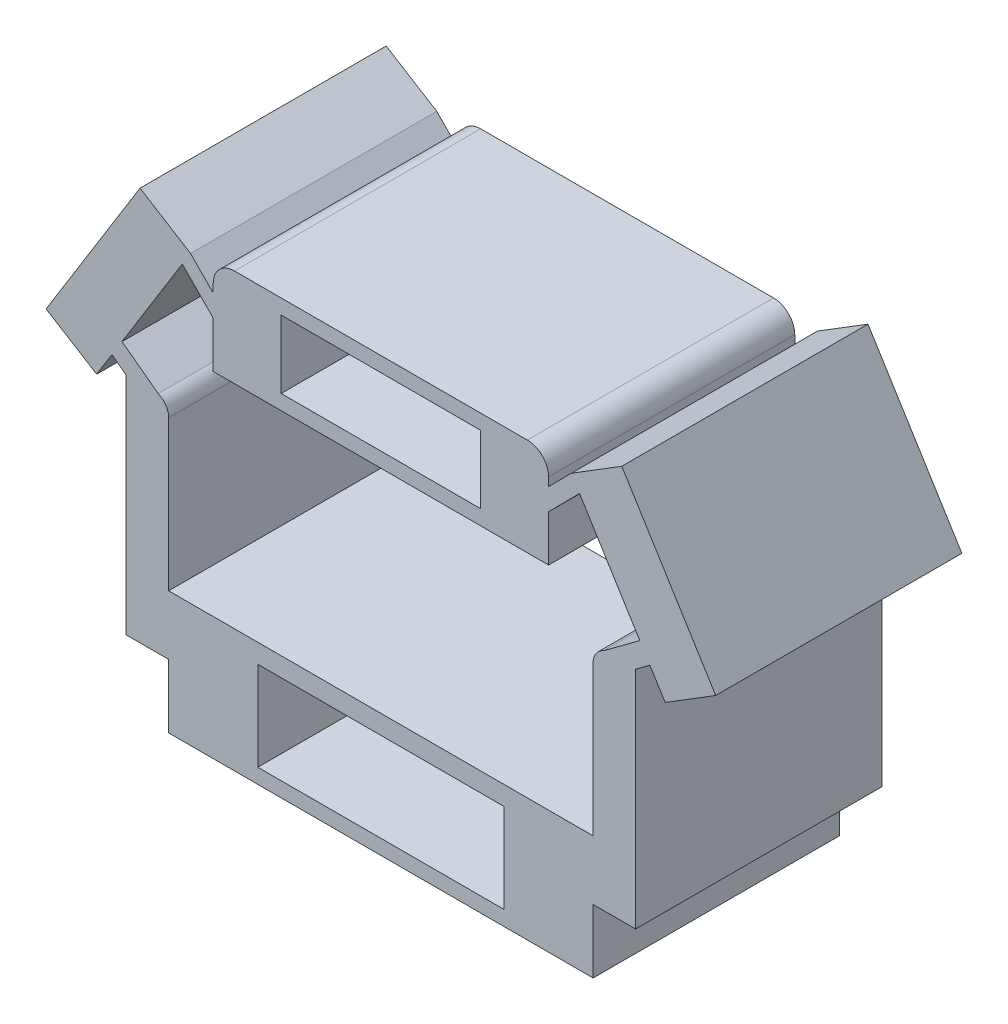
SolidWorks part; units mm, degrees
ref_plane "前视基准面" through (0, 0, 0) normal (0, 0, 1) x (1, 0, 0)
ref_plane "上视基准面" through (0, 0, 0) normal (0, 1, 0) x (1, 0, 0)
ref_plane "右视基准面" through (0, 0, 0) normal (1, 0, 0) x (0, 0, -1)
other "Configuration Table"
sketch "草图1" plane through (0, 0, 0) normal (0, 0, 1) x (1, 0, 0)
  line L0 (3.95, 8) -> (4.4846, 8.5402)
  line L1 (-5, -1.4) -> (5, -1.4)
  line L2 (-5, -1.4) -> (-5, 1.4)
  line L4 (5, -1.4) -> (5, 0)
  line L5 (-5, -1.4) -> (5, 1.4) construction
  line L6 (-5, 1.4) -> (5, -1.4) construction
  line L7 (-3.95, 8) -> (3.95, 8)
  line L8 (-3.95, 8) -> (-3.95, 6.4)
  line L9 (-3.95, 6.4) -> (3.95, 6.4)
  line L10 (3.95, 7.4882) -> (3.95, 6.4)
  line L11 (-3.95, 8) -> (3.95, 6.4) construction
  line L12 (-3.95, 6.4) -> (3.95, 8) construction
  line L14 (5, 0) -> (6, 0)
  line L17 (5.6746, 9.2776) -> (4.4846, 8.5402)
  line L19 (5.6746, 9.2776) -> (7.8869, 5.7075)
  line L33 (3.95, 8) -> (3.95, 7.4882) construction
  line L34 (4.4846, 8.5402) -> (4.6796, 8.2255) construction
  line L37 (6, 5.3) -> (6, 0)
  line L38 (-5, 1.4) -> (5, 1.4)
  line L39 (5, 1.4) -> (5, 0) construction
  line L40 (0, 9.062) -> (0, -4.0269) construction
  line L41 (3.95, 7.4882) -> (4.6796, 8.2255)
  line L48 (4.6796, 8.2255) -> (6.0993, 5.9343)
  line L51 (5.2453, 5.3) -> (6.0993, 5.9343)
  line L53 (6.3372, 5.5504) -> (6.6968, 4.97)
  line L55 (6.0993, 5.9343) -> (6.3372, 5.5504) construction
  line L56 (5.2453, 5.3) -> (6, 5.3) construction
  line L57 (5, 1.4) -> (5, 5.3)
  line L58 (5, 5.3) -> (5.2453, 5.3)
  line L59 (6, 5.3) -> (6.3372, 5.5504)
  line L60 (6.6968, 4.97) -> (7.8869, 5.7075)
  point P0 (0, 0)
  point P6 (0, 7.2)
  dimension "D1" = 10
  dimension "D2" = 2.8
  dimension "D3" = 7.9
  dimension "D4" = 1.6
  dimension "D5" = 1
  dimension "D6" = 36.6
  dimension "D7" = 0.76
  dimension "D8" = 0.36
  dimension "D9" = 5.3
  dimension "D10" = 1.4
  dimension "D11" = 0.45
  dimension "D12" = 3.9
  dimension "D13" = 0.42
  dimension "D14" = 5
  dimension "D15" = 4.2
  dimension "D16" = 135.3
extrude "凸台-拉伸1" add sketch "草图1" along normal blind 5.8
mirror "镜向1" about plane through (0, 0, 0) normal (1, 0, 0) of "凸台-拉伸1"
sketch "草图10" plane through (0, 0, 5.8) normal (0, 0, 1) x (1, 0, 0)
  line L0 (-3.95, 6.4) -> (3.95, 6.4) construction
  line L1 (-2.9, -1.05) -> (2.9, -1.05)
  line L2 (-2.9, -1.05) -> (-2.9, 1.05)
  line L3 (-2.9, 1.05) -> (2.9, 1.05)
  line L4 (2.9, -1.05) -> (2.9, 1.05)
  line L5 (-2.9, -1.05) -> (2.9, 1.05) construction
  line L6 (-2.9, 1.05) -> (2.9, -1.05) construction
  line L7 (-2.35, 8.35) -> (2.35, 8.35)
  line L8 (-2.35, 8.35) -> (-2.35, 6.75)
  line L9 (-2.35, 6.75) -> (2.35, 6.75)
  line L10 (2.35, 8.35) -> (2.35, 6.75)
  point P0 (0, 0)
  point P10 (0, 8.35)
  dimension "D1" = 5.8
  dimension "D2" = 2.1
  dimension "D3" = 4.7
  dimension "D4" = 1.6
  dimension "D5" = 0.35
extrude "切除-拉伸3" cut sketch "草图10" against normal through all
sketch "草图11" plane through (0, 0, 5.8) normal (0, 0, 1) x (1, 0, 0)
  line L0 (-2.35, 8) -> (-3.95, 8)
  line L1 (-3.95, 8) -> (-3.95, 8.7)
  line L2 (-3.95, 8.7) -> (3.95, 8.7)
  line L3 (3.95, 8.7) -> (3.95, 8)
  line L4 (3.95, 6.4) -> (3.95, 7.4882) construction
  line L5 (3.95, 8) -> (2.35, 8)
  line L6 (2.35, 8) -> (2.35, 8.35)
  line L7 (2.35, 8.35) -> (-2.35, 8.35)
  line L8 (-2.35, 8.35) -> (-2.35, 8)
  line L9 (-2.35, 6.75) -> (2.35, 6.75) construction
  dimension "D1" = 0.35
  dimension "D2" = 1.6
extrude "凸台-拉伸2" add sketch "草图11" against normal up to surface (5.8 mm away)
fillet "圆角1" radius 0.5 2 edges at (-3.95, 8.7, 2.9) (3.95, 8.7, 2.9)
sketch "草图12" plane through (0, 0, 5.8) normal (0, 0, 1) x (1, 0, 0)
  line L0 (-2.9, 1.05) -> (-2.9, -1.05) construction
  line L1 (-2.9, 0.95) -> (2.9, 0.95)
  line L2 (-2.9, 0.95) -> (-2.9, 1.05)
  line L3 (-2.9, 1.05) -> (2.9, 1.05)
  line L4 (2.9, 0.95) -> (2.9, 1.05)
  line L5 (5, -1.4) -> (5, 0) construction
  line L6 (-5, -1.4) -> (5, -1.4)
  line L7 (-5, -1.4) -> (-5, -1.5)
  line L8 (-5, -1.5) -> (5, -1.5)
  line L9 (5, -1.4) -> (5, -1.5)
  dimension "D1" = 0.1
  dimension "D2" = 0.1
extrude "凸台-拉伸3" add sketch "草图12" against normal up to surface (5.8 mm away)
sketch "草图14" plane through (0, 0, 5.8) normal (0, 0, 1) x (1, 0, 0)
  line L0 (2.9, -1.05) -> (2.9, 0.95) construction
  line L1 (-2.9, -1.05) -> (2.9, -1.05)
  line L2 (-2.9, -1.05) -> (-2.9, -1.15)
  line L3 (-2.9, -1.15) -> (2.9, -1.15)
  line L4 (2.9, -1.05) -> (2.9, -1.15)
  dimension "D1" = 0.1
extrude "切除-拉伸4" cut sketch "草图14" against normal through all
sketch "草图15" plane through (0, 0, 5.8) normal (0, 0, 1) x (1, 0, 0)
  line L0 (0, 8) -> (0, 1.4)
  line L2 (5, 1.4) -> (-5, 1.4) construction
  line L3 (0, 1.4) -> (5, 1.4)
  line L4 (5, 1.4) -> (5, 5.3)
  line L5 (5, 5.3) -> (6, 5.3)
  line L6 (6, 5.3) -> (6.3372, 5.5504)
  line L7 (6.3372, 5.5504) -> (4.4846, 8.5402)
  line L8 (4.4846, 8.5402) -> (3.95, 8)
  line L9 (3.95, 8) -> (0, 8)
sketch "草图16" plane through (0, 0, 5.8) normal (0, 0, 1) x (1, 0, 0)
  line L0 (-2.35, 8.35) -> (-2.35, 6.75) construction
  line L1 (-2.35, 6.85) -> (2.35, 6.85)
  line L2 (-2.35, 6.85) -> (-2.35, 6.75)
  line L3 (-2.35, 6.75) -> (2.35, 6.75)
  line L4 (2.35, 6.85) -> (2.35, 6.75)
  dimension "D1" = 0.1
extrude "凸台-拉伸4" [suppressed] add sketch "草图16" against normal up to surface (5.8 mm away)
fillet "圆角2" radius 0.4 2 edges at (-5, 5.3, 2.9) (5, 5.3, 2.9)
sketch "草图17" plane through (0, 0, 5.8) normal (0, 0, 1) x (1, 0, 0)
  line L0 (-2.9, 2.0221) -> (-2.9, -1.8376)
  line L1 (-2.35, 6.4076) -> (-2.35, 2.8612)
